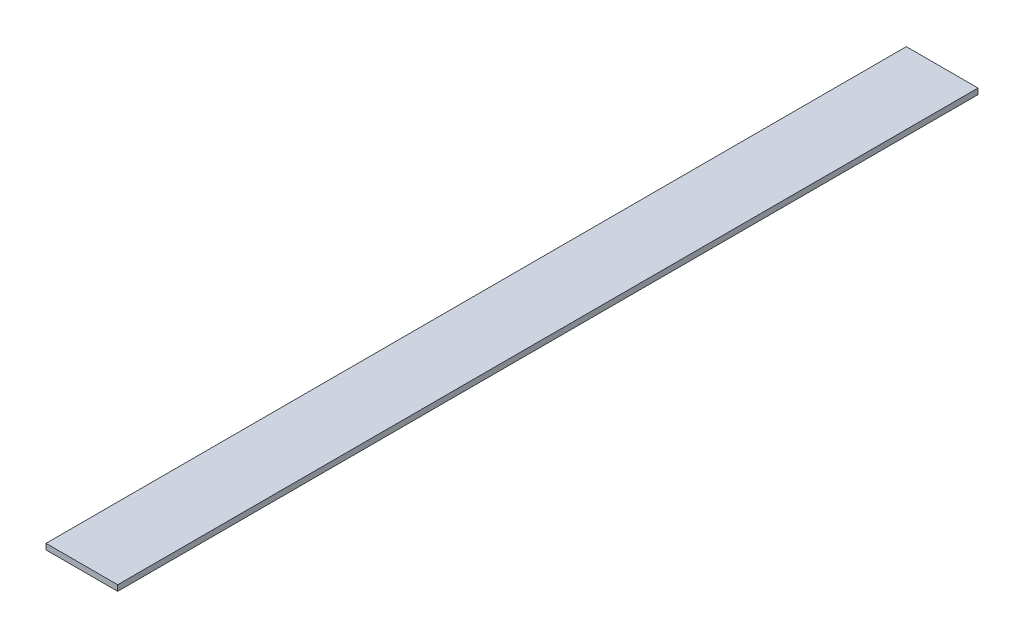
SolidWorks part; units mm, degrees
ref_plane "Front Plane" through (0, 0, 0) normal (0, 0, 1) x (1, 0, 0)
ref_plane "Top Plane" through (0, 0, 0) normal (0, 1, 0) x (1, 0, 0)
ref_plane "Right Plane" through (0, 0, 0) normal (1, 0, 0) x (0, 0, -1)
sketch "Sketch1" plane through (0, 0, 0) normal (0, 1, 0) x (1, 0, 0)
  line L1 (-25.4, -304.8) -> (25.4, -304.8)
  line L2 (-25.4, -304.8) -> (-25.4, 304.8)
  line L3 (-25.4, 304.8) -> (25.4, 304.8)
  line L4 (25.4, -304.8) -> (25.4, 304.8)
  line L5 (-25.4, -304.8) -> (25.4, 304.8) construction
  line L6 (-25.4, 304.8) -> (25.4, -304.8) construction
  point P0 (0, 0)
  dimension "D1" = 50.8
  dimension "D2" = 609.6
extrude "Boss-Extrude1" add sketch "Sketch1" along normal blind 4.064
